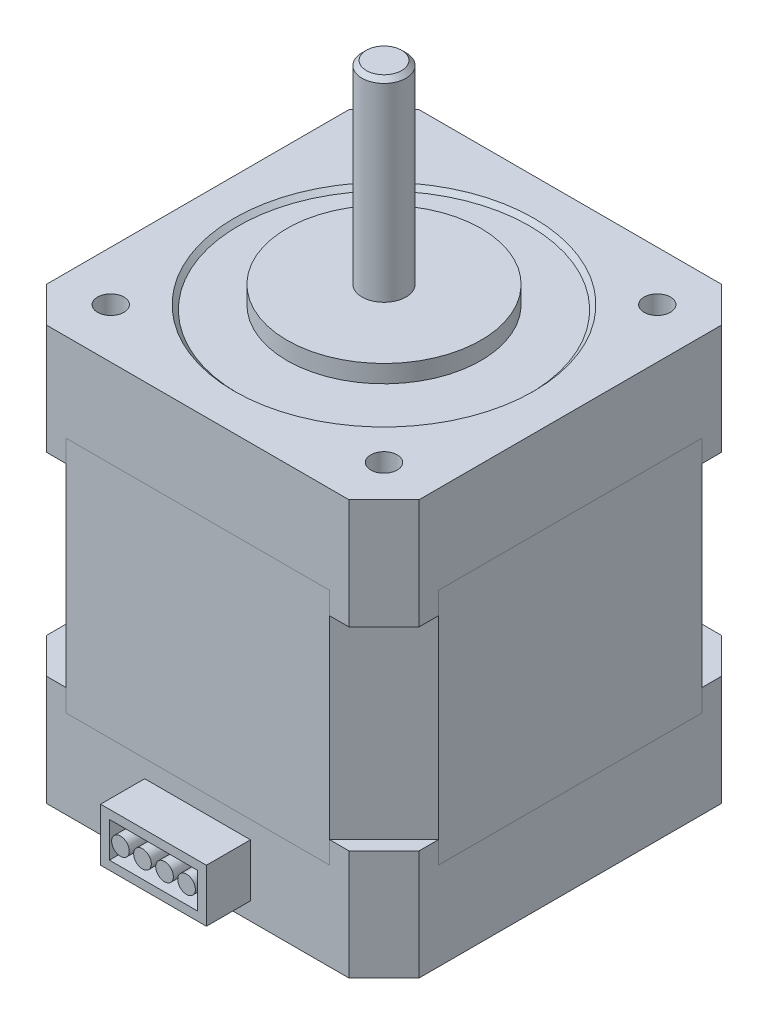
SolidWorks part; units mm, degrees
ref_plane "Front Plane" through (0, 0, 0) normal (0, 0, 1) x (1, 0, 0)
ref_plane "Top Plane" through (0, 0, 0) normal (0, 1, 0) x (1, 0, 0)
ref_plane "Right Plane" through (0, 0, 0) normal (1, 0, 0) x (0, 0, -1)
sketch "Sketch1" plane through (0, 0, 0) normal (0, 1, 0) x (1, 0, 0)
  line L0 (-21.15, 17.1575) -> (-17.1575, 21.15)
  line L1 (-17.1575, -21.15) -> (17.1575, -21.15)
  line L2 (-21.15, -17.1575) -> (-21.15, 17.1575)
  line L3 (-17.1575, 21.15) -> (17.1575, 21.15)
  line L4 (21.15, -17.1575) -> (21.15, 17.1575)
  line L5 (-19.1537, -19.1537) -> (19.1537, 19.1537) construction
  line L6 (-19.1537, 19.1537) -> (19.1537, -19.1537) construction
  line L7 (17.1575, 21.15) -> (21.15, 17.1575)
  line L8 (21.15, -17.1575) -> (17.1575, -21.15)
  line L9 (-17.1575, -21.15) -> (-21.15, -17.1575)
  point P0 (0, 0)
  point P17 (0, 0)
  dimension "D3" = 4
extrude "Boss-Extrude1" add sketch "Sketch1" along normal blind 10
sketch "Sketch2" plane through (0, 10, 0) normal (0, 1, 0) x (1, 0, 0)
  line L0 (-17.1575, 21.15) -> (-21.15, 17.1575)
  line L1 (-21.15, 17.1575) -> (-21.15, 14.9468)
  line L2 (-21.15, 17.1575) -> (-21.15, -17.1575) construction
  line L3 (-21.15, 14.9468) -> (-14.9468, 21.15)
  line L4 (17.1575, 21.15) -> (-17.1575, 21.15) construction
  line L5 (-14.9468, 21.15) -> (-17.1575, 21.15)
  line L6 (21.15, 17.1575) -> (17.1575, 21.15)
  line L7 (17.1575, 21.15) -> (14.9468, 21.15)
  line L8 (14.9468, 21.15) -> (21.15, 14.9468)
  line L9 (21.15, 14.9468) -> (21.15, 17.1575)
  line L10 (17.1575, -21.15) -> (21.15, -17.1575)
  line L11 (21.15, -17.1575) -> (21.15, -14.9468)
  line L12 (21.15, -14.9468) -> (14.9468, -21.15)
  line L13 (14.9468, -21.15) -> (17.1575, -21.15)
  line L14 (-21.15, -17.1575) -> (-17.1575, -21.15)
  line L15 (-17.1575, -21.15) -> (-14.9468, -21.15)
  line L16 (-14.9468, -21.15) -> (-21.15, -14.9468)
  line L17 (-21.15, -14.9468) -> (-21.15, -17.1575)
  point P25 (0, 0)
  dimension "D1" = 4
extrude "Boss-Extrude2" add sketch "Sketch2" along normal blind 2.5
ref_plane "Plane1" through (0, 23.5, 0) normal (0, -1, 0) x (-1, 0, 0)
ref_plane "Plane2" through (0, 47, 0) normal (0, -1, 0) x (-1, 0, 0)
sketch "Sketch6" plane through (0, 47, 0) normal (0, -1, 0) x (-1, 0, 0)
  line L8 (-17.1575, -21.15) -> (17.1575, -21.15)
  line L9 (-21.15, -17.1575) -> (-17.1575, -21.15)
  line L10 (-21.15, 17.1575) -> (-21.15, -17.1575)
  line L11 (-17.1575, 21.15) -> (-21.15, 17.1575)
  line L12 (17.1575, 21.15) -> (-17.1575, 21.15)
  line L13 (21.15, 17.1575) -> (17.1575, 21.15)
  line L14 (21.15, -17.1575) -> (21.15, 17.1575)
  line L15 (17.1575, -21.15) -> (21.15, -17.1575)
  line L16 (-17.1575, -21.15) -> (17.1575, -21.15)
  line L17 (-21.15, -17.1575) -> (-17.1575, -21.15)
  line L18 (-21.15, 17.1575) -> (-21.15, -17.1575)
  line L19 (-17.1575, 21.15) -> (-21.15, 17.1575)
  line L20 (17.1575, 21.15) -> (-17.1575, 21.15)
  line L21 (21.15, 17.1575) -> (17.1575, 21.15)
  line L22 (21.15, -17.1575) -> (21.15, 17.1575)
  line L23 (17.1575, -21.15) -> (21.15, -17.1575)
  dimension "D1" = 0
extrude "Boss-Extrude6" add sketch "Sketch6" along normal blind 10 separate body
sketch "Sketch7" plane through (0, 37, 0) normal (0, -1, 0) x (1, 0, 0)
  line L4 (-21.15, -17.1575) -> (-17.1575, -21.15)
  line L5 (-21.15, -14.9468) -> (-21.15, -17.1575)
  line L6 (-14.9468, -21.15) -> (-21.15, -14.9468)
  line L7 (-17.1575, -21.15) -> (-14.9468, -21.15)
  line L8 (-21.15, -17.1575) -> (-17.1575, -21.15)
  line L9 (-21.15, -14.9468) -> (-21.15, -17.1575)
  line L10 (-14.9468, -21.15) -> (-21.15, -14.9468)
  line L11 (-17.1575, -21.15) -> (-14.9468, -21.15)
  line L12 (-17.1575, 21.15) -> (-21.15, 17.1575)
  line L13 (-14.9468, 21.15) -> (-17.1575, 21.15)
  line L14 (-21.15, 14.9468) -> (-14.9468, 21.15)
  line L15 (-21.15, 17.1575) -> (-21.15, 14.9468)
  line L16 (-17.1575, 21.15) -> (-21.15, 17.1575)
  line L17 (-14.9468, 21.15) -> (-17.1575, 21.15)
  line L18 (-21.15, 14.9468) -> (-14.9468, 21.15)
  line L19 (-21.15, 17.1575) -> (-21.15, 14.9468)
  line L20 (21.15, 17.1575) -> (17.1575, 21.15)
  line L21 (21.15, 14.9468) -> (21.15, 17.1575)
  line L22 (14.9468, 21.15) -> (21.15, 14.9468)
  line L23 (17.1575, 21.15) -> (14.9468, 21.15)
  line L24 (21.15, 17.1575) -> (17.1575, 21.15)
  line L25 (21.15, 14.9468) -> (21.15, 17.1575)
  line L26 (14.9468, 21.15) -> (21.15, 14.9468)
  line L27 (17.1575, 21.15) -> (14.9468, 21.15)
  line L28 (21.15, -14.9468) -> (14.9468, -21.15)
  line L29 (14.9468, -21.15) -> (17.1575, -21.15)
  line L30 (17.1575, -21.15) -> (21.15, -17.1575)
  line L31 (21.15, -17.1575) -> (21.15, -14.9468)
  line L32 (21.15, -14.9468) -> (14.9468, -21.15)
  line L33 (14.9468, -21.15) -> (17.1575, -21.15)
  line L34 (17.1575, -21.15) -> (21.15, -17.1575)
  line L35 (21.15, -17.1575) -> (21.15, -14.9468)
  dimension "D1" = 0
  dimension "D2" = 0
  dimension "D3" = 0
  dimension "D4" = 0
extrude "Boss-Extrude7" add sketch "Sketch7" along normal blind 2.5
sketch "Sketch3" plane through (0, 10, 0) normal (0, 1, 0) x (1, 0, 0)
  line L8 (-21.15, -14.9468) -> (-14.9468, -21.15)
  line L9 (-14.9468, -21.15) -> (14.9468, -21.15)
  line L10 (14.9468, -21.15) -> (21.15, -14.9468)
  line L11 (21.15, -14.9468) -> (21.15, 14.9468)
  line L12 (21.15, 14.9468) -> (14.9468, 21.15)
  line L13 (14.9468, 21.15) -> (-14.9468, 21.15)
  line L14 (-14.9468, 21.15) -> (-21.15, 14.9468)
  line L15 (-21.15, 14.9468) -> (-21.15, -14.9468)
  line L16 (-21.15, -14.9468) -> (-14.9468, -21.15)
  line L17 (-14.9468, -21.15) -> (14.9468, -21.15)
  line L18 (14.9468, -21.15) -> (21.15, -14.9468)
  line L19 (21.15, -14.9468) -> (21.15, 14.9468)
  line L20 (21.15, 14.9468) -> (14.9468, 21.15)
  line L21 (14.9468, 21.15) -> (-14.9468, 21.15)
  line L22 (-14.9468, 21.15) -> (-21.15, 14.9468)
  line L23 (-21.15, 14.9468) -> (-21.15, -14.9468)
  dimension "D1" = 0
extrude "Boss-Extrude8" add sketch "Sketch3" along normal up to body separate body
sketch "Sketch8" plane through (0, 47, 0) normal (0, 1, 0) x (1, 0, 0)
  circle A0 centre (0, 0) radius 11
extrude "Boss-Extrude9" add sketch "Sketch8" along normal blind 2 separate body
sketch "Sketch9" plane through (0, 49, 0) normal (0, 1, 0) x (1, 0, 0)
  circle A0 centre (0, 0) radius 2.5
extrude "Boss-Extrude10" add sketch "Sketch9" along normal blind 22 separate body
chamfer "Chamfer1" distance 0.5 angle 45 1 edges at (0, 71, 2.5)
sketch "Sketch10" plane through (0, 47, 0) normal (0, 1, 0) x (1, 0, 0)
  line L1 (15.5, -15.5) -> (-15.5, -15.5) construction
  line L2 (15.5, -15.5) -> (15.5, 15.5) construction
  line L3 (15.5, 15.5) -> (-15.5, 15.5) construction
  line L4 (-15.5, -15.5) -> (-15.5, 15.5) construction
  line L5 (15.5, -15.5) -> (-15.5, 15.5) construction
  line L6 (15.5, 15.5) -> (-15.5, -15.5) construction
  circle A0 centre (-15.5, 15.5) radius 1.5
  circle A1 centre (15.5, 15.5) radius 1.5
  circle A2 centre (15.5, -15.5) radius 1.5
  circle A3 centre (-15.5, -15.5) radius 1.5
  point P0 (0, 0)
  point P16 (0, 0)
  dimension "D3" = 3
  dimension "D1" = 31
  dimension "D2" = 31
  dimension "D4" = 4
extrude "Cut-Extrude1" cut sketch "Sketch10" against normal blind 5
sketch "Sketch11" plane through (0, 0, 0) normal (0, -1, 0) x (1, 0, 0)
  circle A1 centre (-15.5, 15.5) radius 1.5
  circle A2 centre (-15.5, 15.5) radius 1.5
  circle A3 centre (15.5, 15.5) radius 1.5
  circle A4 centre (15.5, 15.5) radius 1.5
  circle A5 centre (15.5, -15.5) radius 1.5
  circle A6 centre (15.5, -15.5) radius 1.5
  circle A7 centre (-15.5, -15.5) radius 1.5
  circle A8 centre (-15.5, -15.5) radius 1.5
  dimension "D1" = 0
  dimension "D2" = 0
  dimension "D3" = 0
  dimension "D4" = 0
extrude "Cut-Extrude2" cut sketch "Sketch11" against normal blind 5
sketch "Sketch12" plane through (0, 47, 0) normal (0, 1, 0) x (1, 0, 0)
  circle A0 centre (0, 0) radius 15
  dimension "D1" = 30
extrude "Cut-Extrude3" cut sketch "Sketch12" against normal blind 0.5
chamfer "Chamfer2" distance 2 angle 45 1 edges at (0, 47, 15)
sketch "Sketch13" plane through (0, 0, 21.15) normal (0, 0, 1) x (1, 0, 0)
  line L0 (0, 0) -> (0, 3) construction
  line L1 (-14.9468, 10) -> (14.9468, 10) construction
  line L2 (0, 7) -> (0, 10) construction
  line L3 (-5, 3) -> (5, 3)
  line L4 (-5, 3) -> (-5, 7)
  line L5 (-5, 7) -> (5, 7)
  line L6 (5, 3) -> (5, 7)
  line L7 (-6, 2) -> (6, 2)
  line L8 (6, 2) -> (6, 8)
  line L9 (-6, 8) -> (6, 8)
  line L10 (-6, 2) -> (-6, 8)
  point P5 (0, 5)
  dimension "D1" = 10
  dimension "D2" = 4
  dimension "D3" = 1
extrude "Boss-Extrude11" add sketch "Sketch13" along normal blind 5
sketch "Sketch14" plane through (0, 0, 21.15) normal (0, 0, 1) x (1, 0, 0)
  line L0 (0, 7) -> (0, 3) construction
  line L3 (5, 7) -> (-5, 7) construction
  line L4 (-5, 3) -> (5, 3) construction
  line L5 (-5, 5) -> (-2.5, 5) construction
  line L7 (-5, 7) -> (-5, 3) construction
  line L9 (-2.5, 3) -> (-2.5, 7) construction
  line L10 (-5, 3) -> (5, 3) construction
  line L11 (5, 7) -> (-5, 7) construction
  line L12 (2.5, 3) -> (2.5, 7) construction
  line L13 (-2.5, 5) -> (0, 5) construction
  line L14 (0, 5) -> (2.5, 5) construction
  line L15 (2.5, 5) -> (5, 5) construction
  line L16 (5, 3) -> (5, 7) construction
  circle A0 centre (-3.75, 5) radius 1
  circle A1 centre (-1.25, 5) radius 1
  circle A2 centre (1.25, 5) radius 1
  circle A3 centre (3.75, 5) radius 1
extrude "Boss-Extrude12" add sketch "Sketch14" along normal blind 5
